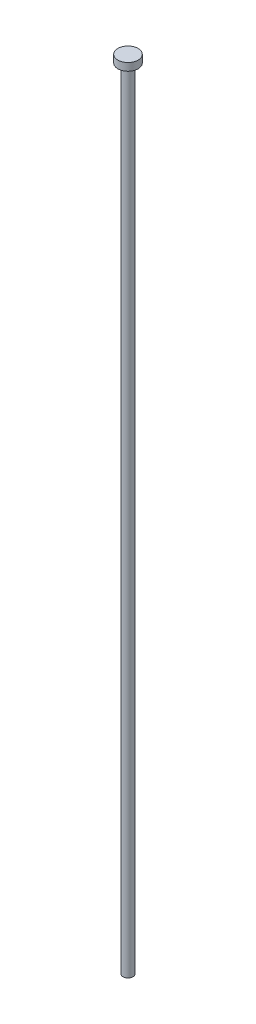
SolidWorks part; units mm, degrees
ref_plane "Front Plane" through (0, 0, 0) normal (0, 0, 1) x (1, 0, 0)
ref_plane "Top Plane" through (0, 0, 0) normal (0, 1, 0) x (1, 0, 0)
ref_plane "Right Plane" through (0, 0, 0) normal (1, 0, 0) x (0, 0, -1)
sketch "PinDia" plane through (0, 0, 0) normal (0, 1, 0) x (1, 0, 0)
  circle A0 centre (0, 0) radius 2
  dimension "D1" = 4
extrude "Length" add sketch "PinDia" against normal blind 315
sketch "HeadDia" plane through (0, 0, 0) normal (0, 1, 0) x (1, 0, 0)
  circle A0 centre (0, 0) radius 4
  dimension "D1" = 8
extrude "HeadThickness" add sketch "HeadDia" against normal blind 3
fillet "Fillet1" radius 0.3 1 edges at (0, -3, 2)
